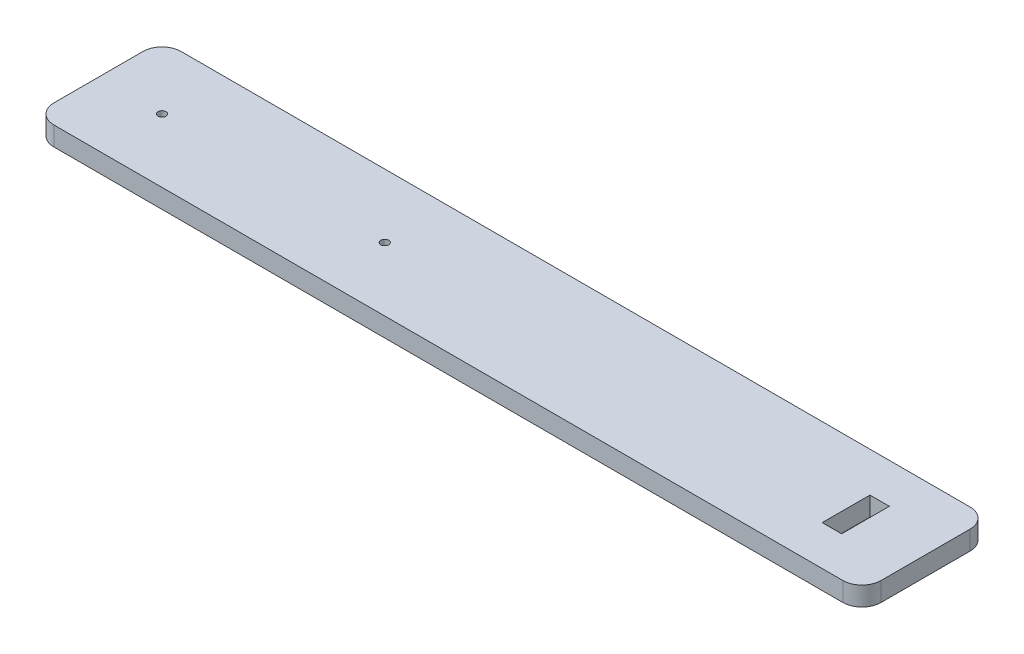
SolidWorks part; units mm, degrees
ref_plane "Ön Düzlem" through (0, 0, 0) normal (0, 0, 1) x (1, 0, 0)
ref_plane "Üst Düzlem" through (0, 0, 0) normal (0, 1, 0) x (1, 0, 0)
ref_plane "Sağ Düzlem" through (0, 0, 0) normal (1, 0, 0) x (0, 0, -1)
sketch "Çizim1" plane through (0, 0, 0) normal (0, 1, 0) x (1, 0, 0)
  line L1 (-130, 20) -> (130, 20)
  line L2 (-130, 20) -> (-130, -20)
  line L3 (-130, -20) -> (130, -20)
  line L4 (130, 20) -> (130, -20)
  line L5 (-130, 20) -> (130, -20) construction
  line L6 (-130, -20) -> (130, 20) construction
  line L7 (105, 7.5) -> (111.1, 7.5)
  line L8 (105, 7.5) -> (105, -7.5)
  line L9 (105, -7.5) -> (111.1, -7.5)
  line L10 (111.1, 7.5) -> (111.1, -7.5)
  line L11 (105, 7.5) -> (111.1, -7.5) construction
  line L12 (105, -7.5) -> (111.1, 7.5) construction
  circle A0 centre (-110, 0) radius 1.25
  circle A1 centre (-40, 0) radius 1.25
  point P0 (0, 0)
  point P10 (108.05, 0)
  dimension "D3" = 20
  dimension "D4" = 20
  dimension "D5" = 2.5
  dimension "D6" = 20
  dimension "D7" = 90
  dimension "D8" = 2.5
  dimension "D1" = 260
  dimension "D2" = 40
  dimension "D9" = 15
  dimension "D10" = 6.1
  dimension "D11" = 12.5
  dimension "D12" = 25
extrude "Yükseklik-Ekstrüzyon1" add sketch "Çizim1" along normal blind 6
fillet "Radyus1" radius 6 4 edges at (-130, 3, 20) (-130, 3, -20) (130, 3, 20) (130, 3, -20)
